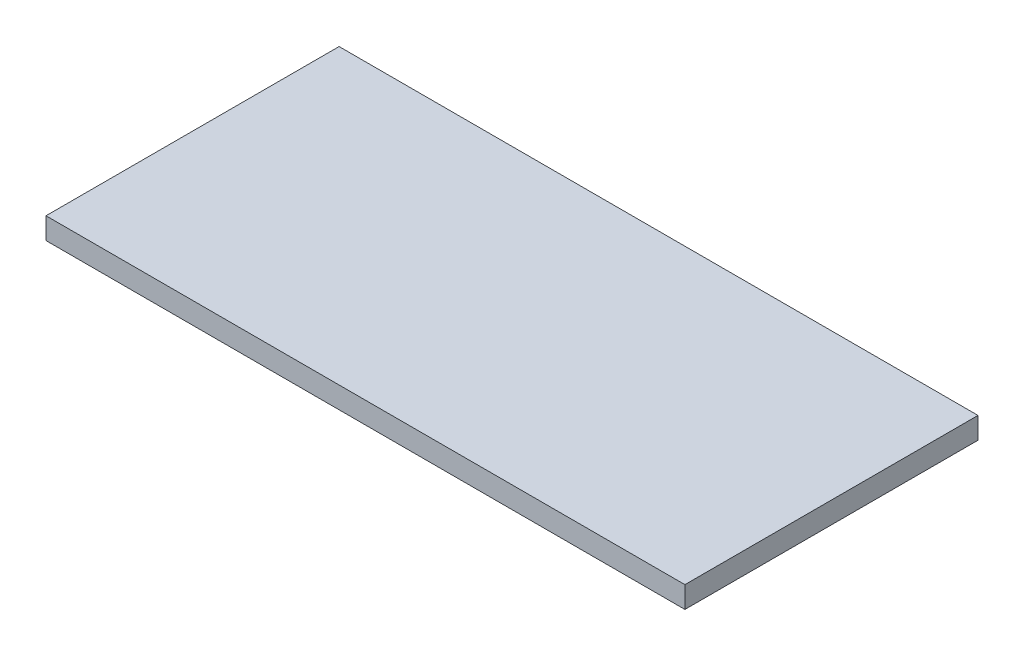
SolidWorks part; units mm, degrees
ref_plane "Plan de face" through (0, 0, 0) normal (0, 0, 1) x (1, 0, 0)
ref_plane "Plan de dessus" through (0, 0, 0) normal (0, 1, 0) x (1, 0, 0)
ref_plane "Plan de droite" through (0, 0, 0) normal (1, 0, 0) x (0, 0, -1)
sketch "Esquisse1" plane through (0, 0, 0) normal (0, 1, 0) x (1, 0, 0)
  line L1 (-151.5, 69.5) -> (151.5, 69.5)
  line L2 (-151.5, 69.5) -> (-151.5, -69.5)
  line L3 (-151.5, -69.5) -> (151.5, -69.5)
  line L4 (151.5, 69.5) -> (151.5, -69.5)
  line L5 (-151.5, 69.5) -> (151.5, -69.5) construction
  line L6 (-151.5, -69.5) -> (151.5, 69.5) construction
  point P0 (0, 0)
  dimension "D1" = 303
  dimension "D2" = 139
extrude "Boss.-Extru.1" add sketch "Esquisse1" along normal mid plane 10.2
